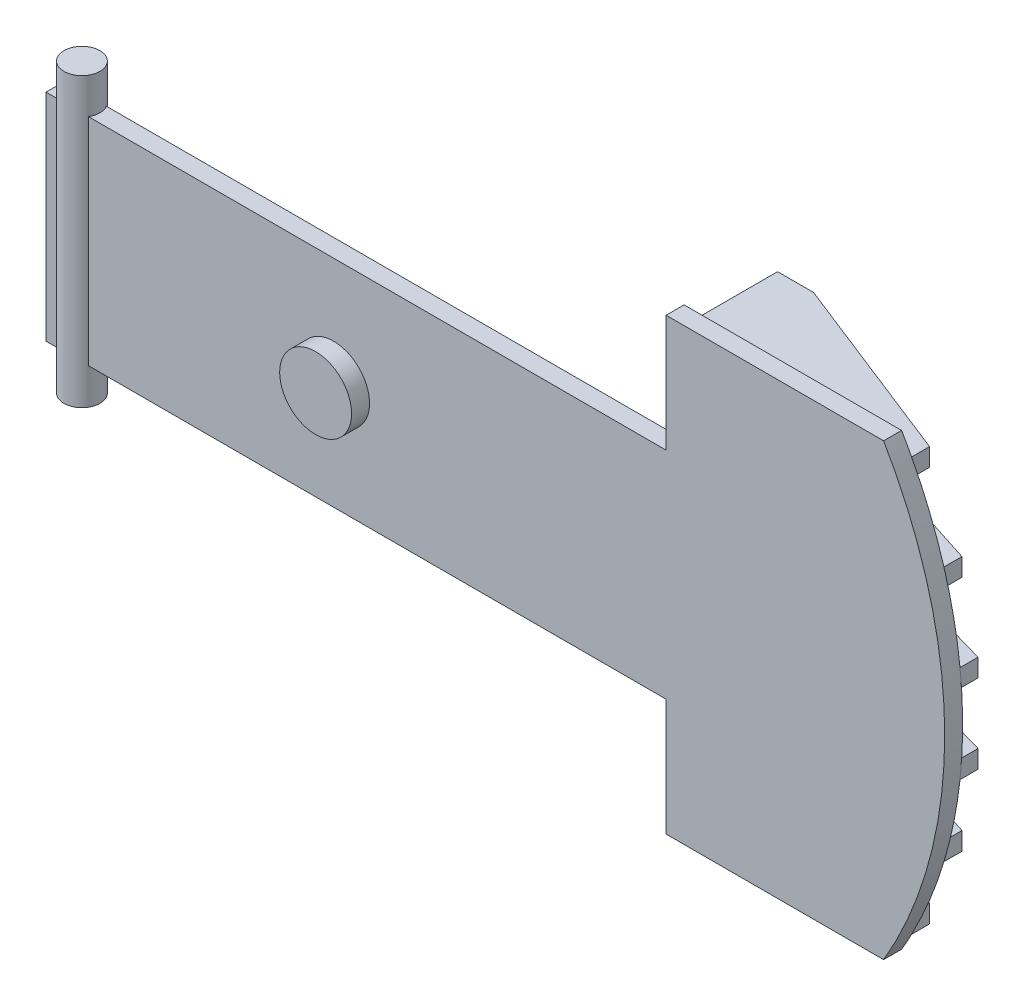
SolidWorks part; units mm, degrees
ref_plane "Plan de face" through (0, 0, 0) normal (0, 0, 1) x (1, 0, 0)
ref_plane "Plan de dessus" through (0, 0, 0) normal (0, 1, 0) x (1, 0, 0)
ref_plane "Plan de droite" through (0, 0, 0) normal (1, 0, 0) x (0, 0, -1)
sketch "Esquisse1" plane through (0, 0, 0) normal (0, 0, 1) x (1, 0, 0)
  line L0 (0, -6) -> (0, 6)
  line L1 (0, 6) -> (34.5, 6)
  line L2 (34.5, 6) -> (34.5, 12.5)
  line L3 (34.5, 12.5) -> (46.6, 12.5)
  line L4 (0, 0) -> (77.8806, 0) construction
  line L5 (50, 18.9929) -> (50, -17.275) construction
  line L6 (34.5, -12.5) -> (46.6, -12.5)
  line L7 (34.5, -6) -> (34.5, -12.5)
  line L8 (0, -6) -> (34.5, -6)
  arc A0 (46.6, 12.5) -> (46.6, -12.5) centre (25.3221, 0) cw
  dimension "D1" = 6
  dimension "D2" = 12.5
  dimension "D3" = 12.1
  dimension "D4" = 50
  dimension "D5" = 34.5
extrude "Extrusion1" add sketch "Esquisse1" along normal blind 1
sketch "Esquisse2" plane through (0, 0, 1) normal (0, 0, 1) x (1, 0, 0)
  line L0 (0, 6) -> (0, -6) construction
  circle A0 centre (16, 0) radius 2
  dimension "D1" = 4
  dimension "D2" = 16
extrude "Extrusion2" add sketch "Esquisse2" along normal blind 1
sketch "Esquisse3" plane through (0, -6, 0) normal (0, -1, 0) x (1, 0, 0)
  line L0 (0, 1) -> (0, 0) construction
  circle A0 centre (1.5, 0.5) radius 1
  point P2 (0, 0.5)
  dimension "D1" = 2
  dimension "D2" = 1.5
extrude "Extrusion3" add sketch "Esquisse3" along normal blind 2 and the other way blind 14
sketch "Esquisse4" plane through (0, 0, 0) normal (0, 0, -1) x (-1, 0, 0)
  line L0 (-34.5, 11.5) -> (-47.1567, 11.5) construction
  line L1 (-34.5, 12.5) -> (-34.5, 6) construction
  line L2 (-46.6, 12.5) -> (-34.5, 12.5) construction
  line L3 (-34.5, 10.5) -> (-47.6548, 10.5) construction
  line L6 (-34.5, 7.1) -> (-48.9566, 7.1) construction
  line L7 (-34.5, 6.1) -> (-49.2342, 6.1) construction
  line L8 (-49.8519, 2.7) -> (-34.5, 2.7) construction
  line L9 (-34.5, 1.7) -> (-49.9414, 1.7) construction
  line L10 (-2.366, 0) -> (-50, 0) construction
  line L11 (-2.366, -6) -> (-2.366, 6) construction
  arc A0 (-46.6, 12.5) -> (-46.6, -12.5) centre (-25.3221, 0) ccw construction
  dimension "D1" = 1
  dimension "D2" = 1
  dimension "D3" = 3.4
  dimension "D4" = 1
  dimension "D5" = 3.4
  dimension "D6" = 1
ref_plane "Plan1" through (0, 11.5, 0) normal (0, 1, 0) x (-1, 0, 0)
ref_plane "Plan2" through (0, 7.1, 0) normal (0, 1, 0) x (-1, 0, 0)
ref_plane "Plan3" through (0, 2.7, 0) normal (0, 1, 0) x (-1, 0, 0)
sketch "Esquisse6" plane through (0, 11.5, 0) normal (0, 1, 0) x (-1, 0, 0)
  line L0 (-34.5, 0) -> (-34.5, -5.2)
  line L1 (-34.5, -5.2) -> (-36.5, -5.2)
  line L2 (-47.1567, 0) -> (-47.1567, -1)
  line L3 (-47.1567, -1) -> (-36.5, -5.2)
  line L4 (-47.1567, 0) -> (-34.5, 0)
  dimension "D1" = 5.2
  dimension "D2" = 2
  dimension "D3" = 1
extrude "Extrusion4" add sketch "Esquisse6" against normal blind 1
sketch "Esquisse7" plane through (0, 7.1, 0) normal (0, 1, 0) x (-1, 0, 0)
  line L0 (-48.9566, 0) -> (-34.5, 0)
  line L1 (-34.5, 0) -> (-34.5, -5)
  line L2 (-34.5, -5.2) -> (-34.5, 0) construction
  line L3 (-34.5, -5) -> (-36.5, -5)
  line L4 (-48.9566, 0) -> (-48.9566, -1)
  line L5 (-48.9566, -1) -> (-36.5, -5)
  dimension "D1" = 5
  dimension "D2" = 2
  dimension "D3" = 1
extrude "Extrusion5" add sketch "Esquisse7" against normal blind 1
sketch "Esquisse8" plane through (0, 2.7, 0) normal (0, 1, 0) x (-1, 0, 0)
  line L0 (-49.8519, 0) -> (-34.5, 0)
  line L1 (-34.5, 0) -> (-34.5, -4.8)
  line L2 (-34.5, -4.8) -> (-36.5, -4.8)
  line L3 (-36.5, -4.8) -> (-49.8519, -1)
  line L4 (-49.8519, -1) -> (-49.8519, 0)
  dimension "D1" = 1
  dimension "D2" = 4.8
  dimension "D3" = 2
extrude "Extrusion6" add sketch "Esquisse8" against normal blind 1
ref_plane "Plan4" through (0, 0, 0) normal (0, -1, 0) x (1, 0, 0)
mirror "Symétrie1" about plane through (0, 0, 0) normal (0, -1, 0) of "Extrusion6", "Extrusion5", "Extrusion4"
